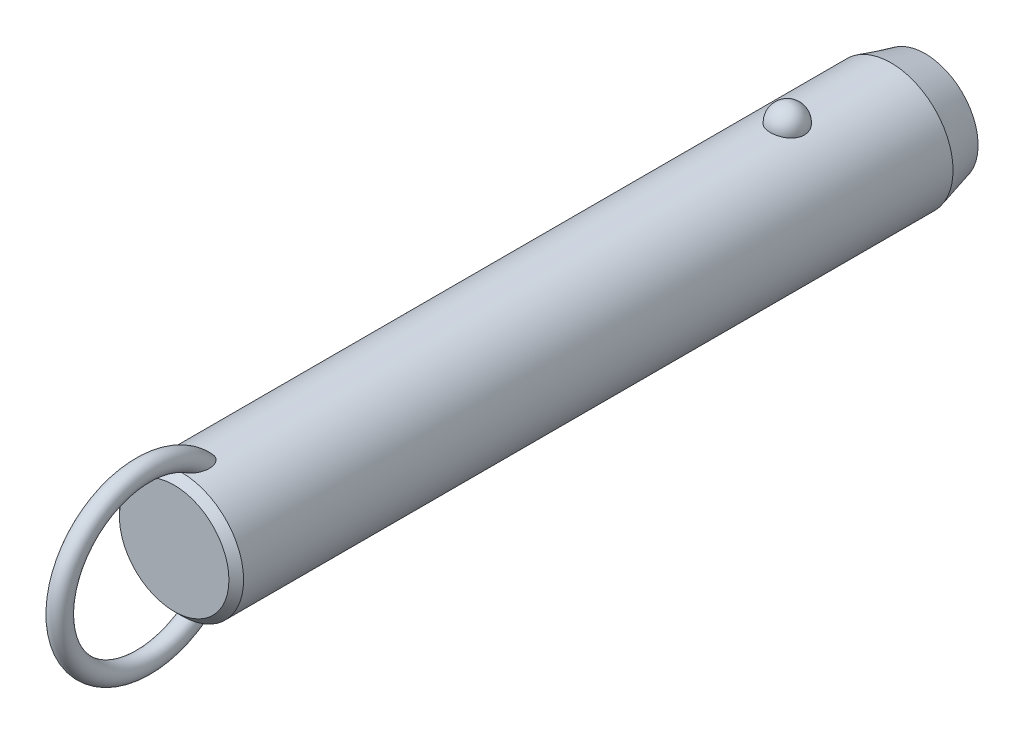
SolidWorks part; units mm, degrees
ref_plane "Front Plane" through (0, 0, 0) normal (0, 0, 1) x (1, 0, 0)
ref_plane "Top Plane" through (0, 0, 0) normal (0, 1, 0) x (1, 0, 0)
ref_plane "Right Plane" through (0, 0, 0) normal (1, 0, 0) x (0, 0, -1)
sketch "Sketch2" plane through (0, 0, 0) normal (0, 0, 1) x (1, 0, 0)
  circle A0 centre (0, 0) radius 12.7
  point P3 (0, 12.7)
  dimension "D1" = 25.4
extrude "Boss-Extrude1" add sketch "Sketch2" along normal blind 109.2
sketch "Sketch3" plane through (0, 0, 0) normal (0, 0, -1) x (-1, 0, 0)
  circle A0 centre (0, 0) radius 12.7
  dimension "D1" = 25.4
extrude "Boss-Extrude2" add sketch "Sketch3" along normal blind 31.7
chamfer "Chamfer1" distance 7 angle 15 1 edges at (-12.7, 0, -31.7)
sketch "Sketch12" plane through (0, 0, 0) normal (1, 0, 0) x (0, 0, -1)
  line L0 (-109.2, 12.7) -> (-109.2, -12.7) construction
  point P0 (-109.2, 0)
sketch "Sketch13" plane through (0, 0, 0) normal (1, 0, 0) x (0, 0, -1)
  circle A0 centre (-128.25, 0) radius 19.05
  point P2 (-109.2, 0)
  dimension "D1" = 38.1
sketch "Sketch14" plane through (0, 0, 0) normal (0, 1, 0) x (1, 0, 0)
  circle A0 centre (0, -111.2) radius 2
  point P2 (0, -109.2)
  dimension "D1" = 4
sweep "Sweep1" add profiles "Sketch14" path "Sketch13"
sketch "Sketch15" plane through (0, 0, 109.2) normal (0, 0, 1) x (1, 0, 0)
  circle A0 centre (0, 0) radius 12.7
  dimension "D1" = 25.4
extrude "Boss-Extrude3" add sketch "Sketch15" along normal blind 12.7
chamfer "Chamfer2" distance 1.5 angle 45 1 edges at (12.7, 0, 121.9)
sketch "Sketch18" plane through (0, 0, 0) normal (1, 0, 0) x (0, 0, -1)
  line L0 (24.7, 12.7) -> (-114.051, 12.7) construction
  line L1 (3.5, 16.2) -> (3.5, 9.2)
  line L2 (-114.051, -12.7) -> (24.7, -12.7) construction
  arc A0 (3.5, 16.2) -> (3.5, 9.2) centre (3.5, 12.7) ccw
  point P4 (0, 12.7)
  dimension "D1" = 28.9
revolve "Revolve1" add sketch "Sketch18" angle 360 about L1
